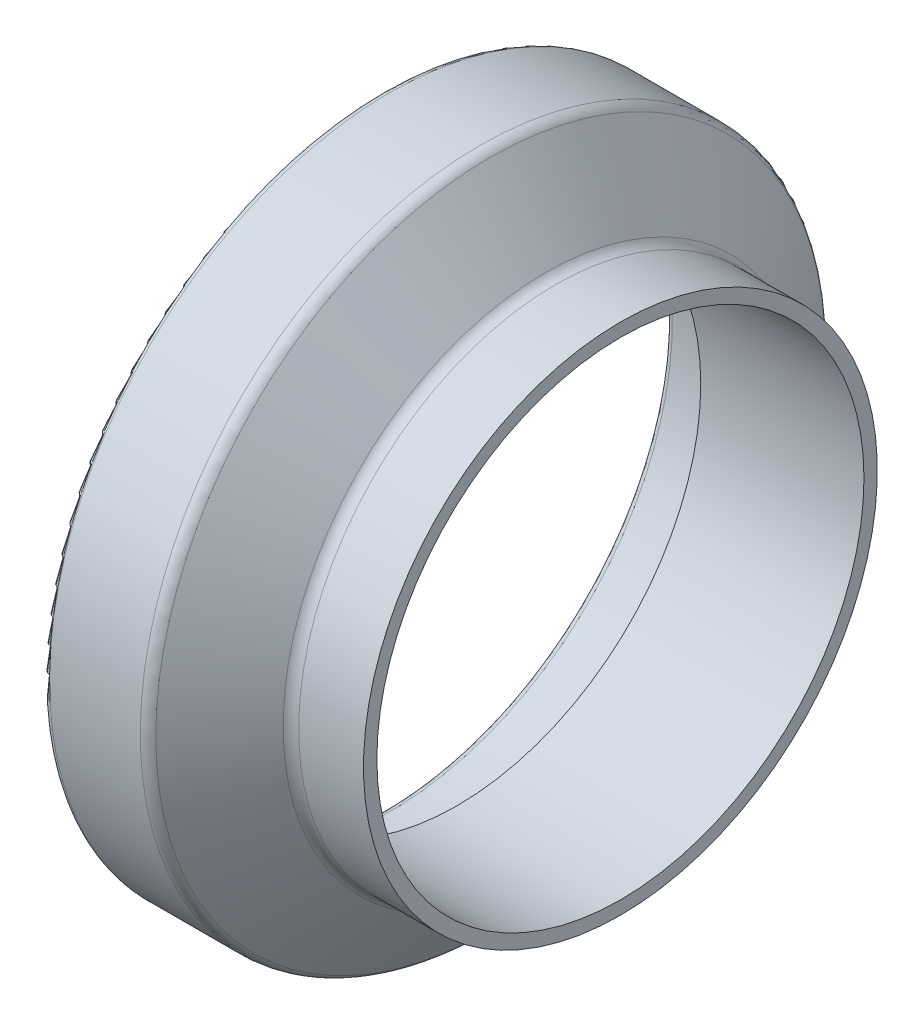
SolidWorks part; units mm, degrees
ref_plane "Front Plane" through (0, 0, 0) normal (0, 0, 1) x (1, 0, 0)
ref_plane "Top Plane" through (0, 0, 0) normal (0, 1, 0) x (1, 0, 0)
ref_plane "Right Plane" through (0, 0, 0) normal (1, 0, 0) x (0, 0, -1)
sketch "Sketch1" plane through (0, 0, 0) normal (0, 0, 1) x (1, 0, 0)
  line L0 (0, 0) -> (-52.2554, 0) construction
  line L1 (-6.4272, 30.099) -> (-26.5948, 30.099)
  line L2 (-26.5948, 30.099) -> (-26.5948, 34.1503)
  line L3 (-27.4076, 34.9631) -> (-34.9768, 34.9631)
  line L4 (-35.7896, 35.7759) -> (-35.7896, 41.1861)
  line L5 (-34.9768, 41.9989) -> (-23.7604, 41.9989)
  line L6 (-22.4824, 41.3617) -> (-15.7196, 32.3872)
  line L7 (-14.4417, 31.75) -> (-6.4272, 31.75)
  line L8 (-6.4272, 31.75) -> (-6.4272, 30.099)
  arc A0 (-34.9768, 41.9989) -> (-35.7896, 41.1861) centre (-34.9768, 41.1861) ccw
  arc A1 (-35.7896, 35.7759) -> (-34.9768, 34.9631) centre (-34.9768, 35.7759) ccw
  arc A2 (-27.4076, 34.9631) -> (-26.5948, 34.1503) centre (-27.4076, 34.1503) cw
  arc A3 (-14.4417, 31.75) -> (-15.7196, 32.3872) centre (-14.4417, 33.3502) cw
  arc A4 (-22.4824, 41.3617) -> (-23.7604, 41.9989) centre (-23.7604, 40.3987) ccw
  point P13 (-35.7896, 41.9989)
  point P16 (-35.7896, 34.9631)
  point P23 (-22.9626, 41.9989)
  dimension "D9" = 0.8128
  dimension "D10" = 1.6002
  dimension "D1" = 41.9989
  dimension "D2" = 37
  dimension "D3" = 34.9631
  dimension "D4" = 30.099
  dimension "D5" = 12.827
  dimension "D6" = 9.1948
  dimension "D7" = 29.3624
  dimension "D8" = 31.75
revolve "Revolve1" add sketch "Sketch1" angle 360 about L0
